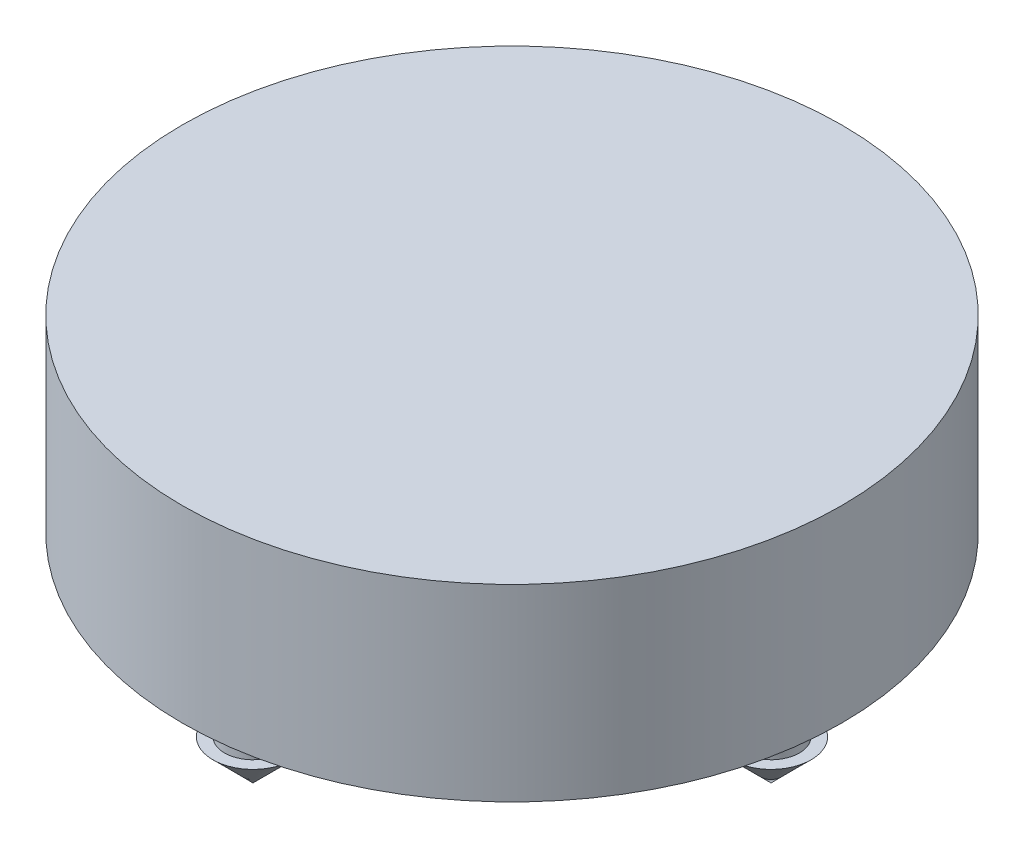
SolidWorks part; units mm, degrees
ref_plane "Front Plane" through (0, 0, 0) normal (0, 0, 1) x (1, 0, 0)
ref_plane "Top Plane" through (0, 0, 0) normal (0, 1, 0) x (1, 0, 0)
ref_plane "Right Plane" through (0, 0, 0) normal (1, 0, 0) x (0, 0, -1)
sketch "Sketch1" plane through (0, 0, 0) normal (0, 0, 1) x (1, 0, 0)
  line L0 (0, 0) -> (0, 20) construction
  line L1 (0, 0) -> (35, 0) construction
  line L2 (0, 20) -> (35, 20)
  line L3 (35, 20) -> (35, 0)
  line L4 (35, 0) -> (20, 0)
  line L5 (20, 0) -> (20, 15)
  line L6 (20, 15) -> (0, 15)
  line L7 (0, 20) -> (0, 15)
  line L8 (10, 15) -> (10, 0) construction
  line L9 (0, 7.5) -> (20, 7.5) construction
  dimension "D1" = 35
  dimension "D2" = 20
  dimension "D3" = 20
  dimension "D4" = 15
revolve "Revolve1" add sketch "Sketch1" angle 360 about L0
sketch "Sketch2" plane through (0, 15, 0) normal (0, -1, 0) x (1, 0, 0)
  circle A0 centre (0, 0) radius 10
  dimension "D1" = 20
extrude "Boss-Extrude2" add sketch "Sketch2" along normal blind 18 draft 10 contours A0
sketch "Sketch8" plane through (0, 0, 0) normal (0, 0, 1) x (1, 0, 0)
  line L0 (0, 20) -> (0, 0) construction
  line L1 (-3.5, 12.6432) -> (3.5, 12.6432)
  line L2 (-3.5, 12.6432) -> (-3.5, 8.6432)
  line L3 (-3.5, 8.6432) -> (3.5, 8.6432)
  line L4 (3.5, 12.6432) -> (3.5, 8.6432)
  line L5 (-3.5, 12.6432) -> (3.5, 8.6432) construction
  line L6 (-3.5, 8.6432) -> (3.5, 12.6432) construction
  point P0 (0, 10.6432)
  dimension "D1" = 4
  dimension "D2" = 7
extrude "Cut-Extrude6" cut sketch "Sketch8" against normal blind 31 from offset 15
sketch "Sketch10" plane through (0, 15, 0) normal (0, -1, 0) x (1, 0, 0)
  line L1 (-0.9065, 16.5605) -> (0.9065, 16.5605)
  line L2 (-0.9065, 16.5605) -> (-0.9065, -16.5605)
  line L3 (-0.9065, -16.5605) -> (0.9065, -16.5605)
  line L4 (0.9065, 16.5605) -> (0.9065, -16.5605)
  line L5 (-0.9065, 16.5605) -> (0.9065, -16.5605) construction
  line L6 (-0.9065, -16.5605) -> (0.9065, 16.5605) construction
  point P0 (0, 0)
extrude "Cut-Extrude8" cut sketch "Sketch10" along normal blind 18
sketch "Sketch15" plane through (0, 0, 0) normal (0, -1, 0) x (1, 0, 0)
  line L0 (20, 0) -> (35, 0) construction
  circle A0 centre (0, 0) radius 20 construction
  circle A1 centre (0, 0) radius 20 construction
  circle A2 centre (0, 0) radius 35 construction
  circle A3 centre (27.5, 0) radius 3
  dimension "D1" = 6
extrude "Boss-Extrude8" add sketch "Sketch15" along normal blind 5
pattern_circular "CirPattern1" count 4 over 360 about axis through (0, 0, 0) along (0, 1, 0) of "Boss-Extrude8"
sketch "Sketch16" plane through (0, -5, 0) normal (0, -1, 0) x (1, 0, 0)
  circle A2 centre (0, 27.5) radius 4.25
  circle A3 centre (0, 27.5) radius 4.25
  dimension "D1" = 1.25
extrude "Boss-Extrude9" add sketch "Sketch16" along normal blind 5 draft 45
pattern_circular "CirPattern2" count 4 over 360 about axis through (0, 0, 0) along (0, 1, 0) of "Boss-Extrude9"
